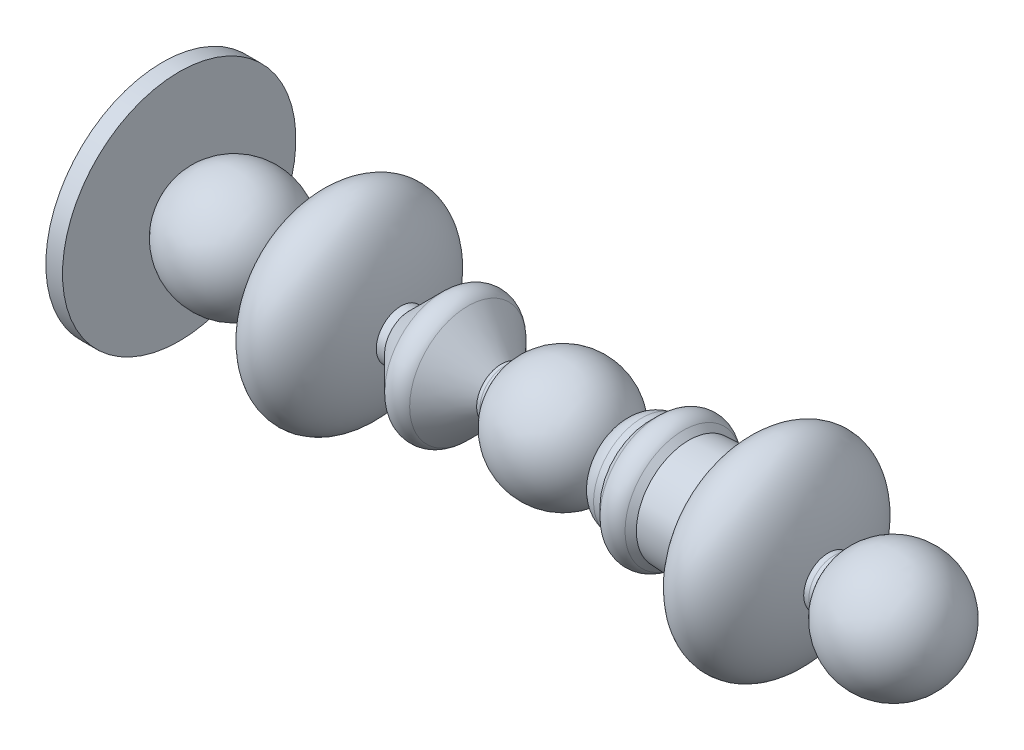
SolidWorks part; units mm, degrees
ref_plane "Alzado" through (0, 0, 0) normal (0, 0, 1) x (1, 0, 0)
ref_plane "Planta" through (0, 0, 0) normal (0, 1, 0) x (1, 0, 0)
ref_plane "Vista lateral" through (0, 0, 0) normal (1, 0, 0) x (0, 0, -1)
sketch "Croquis1" plane through (0, 0, 0) normal (0, 0, 1) x (1, 0, 0)
  line L0 (-82.5, 0) -> (82.5, 0)
  line L1 (-82.5, 103.993) -> (-82.5, 0) construction
  line L2 (82.5, 116.0803) -> (82.5, 35.9687) construction
  line L3 (82.5, 0) -> (82.5, -116.9372) construction
  line L4 (-82.5, 35.9687) -> (-82.5, 0)
  line L5 (82.5, 35.9687) -> (82.5, 0)
  arc A0 (82.5, 35.9687) -> (-82.5, 35.9687) centre (0, 0) ccw
  dimension "D1" = 180
  dimension "D2" = 82.5
  dimension "D3" = 165
revolve "Revolución1" add sketch "Croquis1" angle 360 about L0
sketch "Croquis2" plane through (0, 0, 0) normal (0, 0, 1) x (1, 0, 0)
  line L0 (0, 0) -> (577.9569, 0) construction
  line L1 (235.5, 28.0307) -> (235.5, -954.667) construction
  line L3 (87.5, 0) -> (87.5, 37.5)
  line L4 (107.7869, 80) -> (520.2734, 80) construction
  line L5 (383.5, 0) -> (383.5, 37.5)
  line L8 (87.5, 0) -> (383.5, 0)
  line L11 (82.5, -35.9687) -> (82.5, 35.9687) construction
  arc A1 (118.6884, 72.7911) -> (87.5, 37.5) centre (123.0609, 37.5) ccw
  arc A2 (383.5, 37.5) -> (352.3116, 72.7911) centre (347.9391, 37.5) ccw
  arc A3 (352.3116, 72.7911) -> (118.6884, 72.7911) centre (235.5, -870) ccw
  point P8 (82.5, 0)
  dimension "D3" = 1900
  dimension "D4" = 37.5
  dimension "D5" = 296
  dimension "D6" = 80
  dimension "D1" = 5
revolve "Revolución2" add sketch "Croquis2" angle 360 about L8
sketch "Croquis3" plane through (0, 0, 0) normal (0, 0, 1) x (1, 0, 0)
  line L0 (0, 0) -> (875.0701, 0) construction
  line L1 (92.5, 37) -> (142.7218, 87.2218)
  line L3 (180.2782, 87.2218) -> (230.5, 37)
  line L5 (768.249, 95) -> (318.4197, 95) construction
  line L6 (92.5, 0) -> (92.5, 37)
  line L7 (230.5, 0) -> (230.5, 37)
  line L8 (92.5, 0) -> (230.5, 0)
  line L12 (82.5, -35.9687) -> (82.5, 35.9687) construction
  arc A0 (180.2782, 87.2218) -> (142.7218, 87.2218) centre (161.5, 68.4437) ccw
  point P4 (161.5, 0)
  dimension "D1" = 95
  dimension "D2" = 138
  dimension "D3" = 10
  dimension "D4" = 37
  dimension "D5" = 90
revolve "Revolución3" add sketch "Croquis3" angle 360 about L8
sketch "Croquis8" plane through (0, 0, 0) normal (0, 0, 1) x (1, 0, 0)
  line L0 (0, 0) -> (818.4274, 0) construction
  line L1 (230.5, -37) -> (230.5, 37) construction
  line L2 (240.5, 0) -> (400.5, 0)
  ellipse E0 centre (320.5, 0) end of major axis (320.5, 150) minor radius 80 (400.5, 0) -> (240.5, 0) ccw
  dimension "D1" = 160
  dimension "D2" = 300
  dimension "D3" = 10
revolve "Revolución6" add sketch "Croquis8" angle 360 about L0
sketch "Croquis10" plane through (0, 0, 0) normal (0, 0, 1) x (1, 0, 0)
  line L0 (0, 0) -> (235.5, 0) construction
  line L1 (82.5, -35.9687) -> (82.5, 35.9687) construction
  line L2 (82.5, 0) -> (92.5, 0)
  line L3 (82.5, 0) -> (82.5, 37)
  line L4 (82.5, 37) -> (92.5, 37)
  line L5 (92.5, 0) -> (92.5, 37)
  line L6 (235.5, 0) -> (235.5, 37)
  line L7 (230.5, 37) -> (235.5, 37)
  line L8 (230.5, 37) -> (230.5, 0)
  line L9 (230.5, 0) -> (235.5, 0)
  line L11 (400.6242, 0) -> (410.6242, 0)
  line L12 (400.6242, 0) -> (400.6242, 37)
  line L13 (400.6242, 37) -> (410.6242, 37)
  line L14 (410.6242, 0) -> (410.6242, 37)
  line L15 (240.5, 0) -> (476.4351, 0) construction
  dimension "D2" = 10
  dimension "D3" = 37
revolve "Revolución8" add sketch "Croquis10" angle 360 about L0
sketch "Croquis9" plane through (0, 0, 0) normal (0, 0, 1) x (1, 0, 0)
  line L0 (0, 0) -> (633.0272, 0) construction
  line L1 (410.6242, 30) -> (410.6242, 0)
  line L2 (410.6242, 0) -> (585.477, 0)
  line L3 (410.6242, -37) -> (410.6242, 37) construction
  arc A0 (585.477, 0) -> (410.6242, 30) centre (495.477, 0) ccw
  point P6 (398.5194, 0)
  dimension "D1" = 180
  dimension "D2" = 30
revolve "Revolución7" add sketch "Croquis9" angle 360 about L2
mirror "Simetría3" about plane through (0, 0, 0) normal (1, 0, 0)
sketch "Croquis11" plane through (0, 0, 0) normal (0, 1, 0) x (1, 0, 0)
  line L3 (233, -37) -> (233, 37) construction
  line L4 (230.5, -37) -> (235.5, -37) construction
  line L5 (235.5, 37) -> (230.5, 37) construction
  circle A0 centre (233, 0) radius 5
  dimension "D1" = 10
sketch "Croquis13" plane through (0, 0, 0) normal (0, 0, 1) x (1, 0, 0)
  line L0 (-82.5, 0) -> (-410.6242, 0) construction
  line L9 (-410.6242, 37) -> (-410.6242, -37) construction
  line L10 (-246.5621, 256.3884) -> (-246.5621, -256.3884)
  line L11 (-82.5, -37) -> (-82.5, 37) construction
  point P10 (320.5621, 0)
  point P13 (-246.5621, 0)
ref_plane "Plano2" through (-246.5621, 0, 0) normal (1, 0, 0) x (0, 0, -1)
mirror "Simetría6" about plane through (-246.5621, 0, 0) normal (1, 0, 0)
sketch "Croquis14" plane through (0, 0, 0) normal (0, 0, 1) x (1, 0, 0)
  line L0 (-410.6242, 0) -> (-575.6242, 0) construction
  line L1 (-575.6242, 35.9687) -> (-575.6242, -35.9687) construction
  line L2 (-493.1242, -117.4687) -> (-493.1242, 117.4687)
  point P8 (-493.1242, 0)
ref_plane "Plano3" through (-493.1242, 0, 0) normal (1, 0, 0) x (0, 0, -1)
sketch "Croquis19" plane through (235.5, 0, 0) normal (1, 0, 0) x (0, 0, -1)
  circle A1 centre (0, 0) radius 37
  circle A2 centre (0, 0) radius 37
  dimension "D1" = 0
extrude "Saliente-Extruir5" add sketch "Croquis19" along normal up to next
sketch "Croquis20" plane through (-235.5, 0, 0) normal (-1, 0, 0) x (0, 0, 1)
  circle A1 centre (0, 0) radius 37
  circle A2 centre (0, 0) radius 37
  dimension "D1" = 0
extrude "Saliente-Extruir6" add sketch "Croquis20" along normal up to next
sketch "Croquis21" plane through (-400.6242, 0, 0) normal (1, 0, 0) x (0, 0, -1)
  circle A1 centre (0, 0) radius 37
  circle A2 centre (0, 0) radius 37
  dimension "D1" = 0
extrude "Saliente-Extruir7" add sketch "Croquis21" along normal up to next
sketch "Croquis22" plane through (400.6242, 0, 0) normal (-1, 0, 0) x (0, 0, 1)
  circle A1 centre (0, 0) radius 37
  circle A2 centre (0, 0) radius 37
  dimension "D1" = 0
extrude "Saliente-Extruir8" add sketch "Croquis22" along normal up to next
sketch "Croquis23" plane through (410.6242, 0, 0) normal (1, 0, 0) x (0, 0, -1)
  circle A1 centre (0, 0) radius 37
  circle A2 centre (0, 0) radius 37
  dimension "D1" = 0
extrude "Saliente-Extruir9" add sketch "Croquis23" along normal up to next
sketch "Croquis24" plane through (0, 0, 0) normal (0, 1, 0) x (1, 0, 0)
  line L0 (405.7312, -37) -> (405.7312, 37)
  line L3 (398.028, -37) -> (413.4343, -37) construction
  line L4 (413.4343, 37) -> (398.028, 37) construction
  line L5 (87.5, -37) -> (87.5, 37)
  line L6 (82.5, -37) -> (92.5, -37) construction
  line L7 (92.5, 37) -> (82.5, 37) construction
  line L8 (-87.5, -37) -> (-87.5, 37)
  line L9 (-92.5, -37) -> (-82.5, -37) construction
  line L10 (-82.5, 37) -> (-92.5, 37) construction
  line L11 (-404.3261, -37) -> (-404.3261, 37)
  line L12 (-410.6242, -37) -> (-398.028, -37) construction
  line L13 (-398.028, 37) -> (-410.6242, 37) construction
sketch "Croquis26" plane through (-575.6242, 0, 0) normal (-1, 0, 0) x (0, 0, 1)
  circle A0 centre (0, 0) radius 175
  dimension "D1" = 350
extrude "Saliente-Extruir11" add sketch "Croquis26" along normal blind 25
